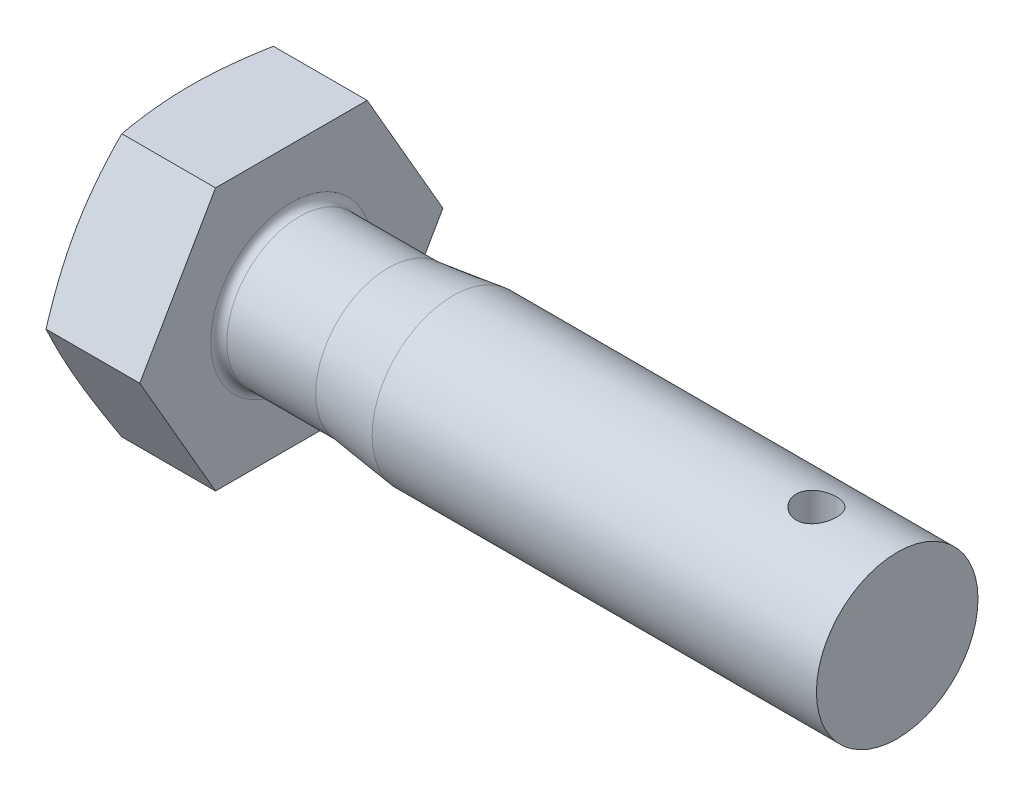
SolidWorks part; units mm, degrees
ref_plane "Front" through (0, 0, 0) normal (0, 0, 1) x (1, 0, 0)
ref_plane "Top" through (0, 0, 0) normal (0, 1, 0) x (1, 0, 0)
ref_plane "Right" through (0, 0, 0) normal (1, 0, 0) x (0, 0, -1)
sketch "Sketch1" plane through (0, 0, 0) normal (1, 0, 0) x (0, 0, -1)
  line L1 (3.7528, -6.5) -> (7.5056, 0)
  line L2 (7.5056, 0) -> (3.7528, 6.5)
  line L3 (3.7528, 6.5) -> (-3.7528, 6.5)
  line L4 (-3.7528, 6.5) -> (-7.5056, 0)
  line L5 (-7.5056, 0) -> (-3.7528, -6.5)
  line L6 (-3.7528, -6.5) -> (3.7528, -6.5)
  circle A0 centre (0, 0) radius 6.5 construction
  dimension "s" = 13
extrude "BaseHead" add sketch "Sketch1" along normal blind 5.3
ref_plane "Plane1" through (13.3, 0, 0) normal (1, 0, 0) x (0, 0, -1)
sketch "Sketch2" plane through (5.3, 0, 0) normal (1, 0, 0) x (0, 0, -1)
  circle A0 centre (0, 0) radius 4
  dimension "d" = 8
extrude "BaseBody" add sketch "Sketch2" along normal blind 30
sketch "Sketch3" plane through (3.1612, 0, 2.6123) normal (0, 1, 0) x (0, 0, -1)
  line L0 (2.6123, 2.0714) -> (2.6123, -1.5224) construction
  line L2 (10.1178, 3.1612) -> (10.1178, 2.504)
  line L3 (10.1178, 2.504) -> (8.3123, 3.1612)
  line L5 (8.3123, 3.1612) -> (10.1178, 3.1612)
  dimension "D1" = 20
  dimension "dw" = 11.4
revolve "HeadChamfer" cut sketch "Sketch3" angle 360 about L0
sketch "Sketch4" plane through (0, 0, 0) normal (1, 0, 0) x (0, 0, -1)
  circle A0 centre (0, 0) radius 4.6
  dimension "da" = 9.2
extrude "Cut-Extrude1" cut sketch "Sketch4" along normal blind 1.06
sketch "Sketch5" plane through (-2.9296, 0, 7.9296) normal (0, 1, 0) x (0, 0, -1)
  line L0 (7.9296, -2.9296) -> (7.9296, -19.1832) construction
  line L1 (15.4352, -8.2296) -> (11.6824, -8.2296) construction
  line L2 (11.9296, -16.2296) -> (11.5236, -13.0296)
  line L3 (10.9296, -2.9296) -> (10.9296, -19.1832) construction
  line L4 (11.5236, -13.0296) -> (11.5236, -8.2296)
  line L5 (11.9296, -38.2296) -> (11.9296, -8.2296) construction
  line L6 (11.5236, -8.2296) -> (15.1176, -8.2296)
  line L7 (15.1176, -8.2296) -> (15.1176, -16.2296)
  line L8 (15.1176, -16.2296) -> (11.9296, -16.2296)
  line L9 (3.9296, -38.2296) -> (11.9296, -38.2296) construction
  dimension "D1" = 3
  dimension "ds" = 7.188
  dimension "x" = 3.2
  dimension "D3" = 22
  dimension "D4" = 14.376
revolve "Cut-Revolve1" cut sketch "Sketch5" angle 360 about L0
fillet "HeadFillet" radius 0.4 1 edges at (5.3, 0, 3.594)
sketch "Sketch6" plane through (0, 0, 0) normal (0, 1, 0) x (1, 0, 0)
  line L0 (5.3, -3.7528) -> (5.3, -7.5056) construction
  circle A0 centre (31.3, 0) radius 1
  dimension "d1" = 2
  dimension "lh" = 26
extrude "Hole" cut sketch "Sketch6" against normal through all and the other way through all
equation "\"D1@Cut-Extrude1\" = 0.2 * \"k@BaseHead\""
equation "\"b@ThreadCosmetic1\" = \"l@BaseBody\" - \"lg@Plane1\""
equation "\"D4@Sketch5\" = 2 * \"ds@Sketch5\""
equation "\"D3@Sketch5\" = \"l@BaseBody\" - \"lg@Plane1\""
